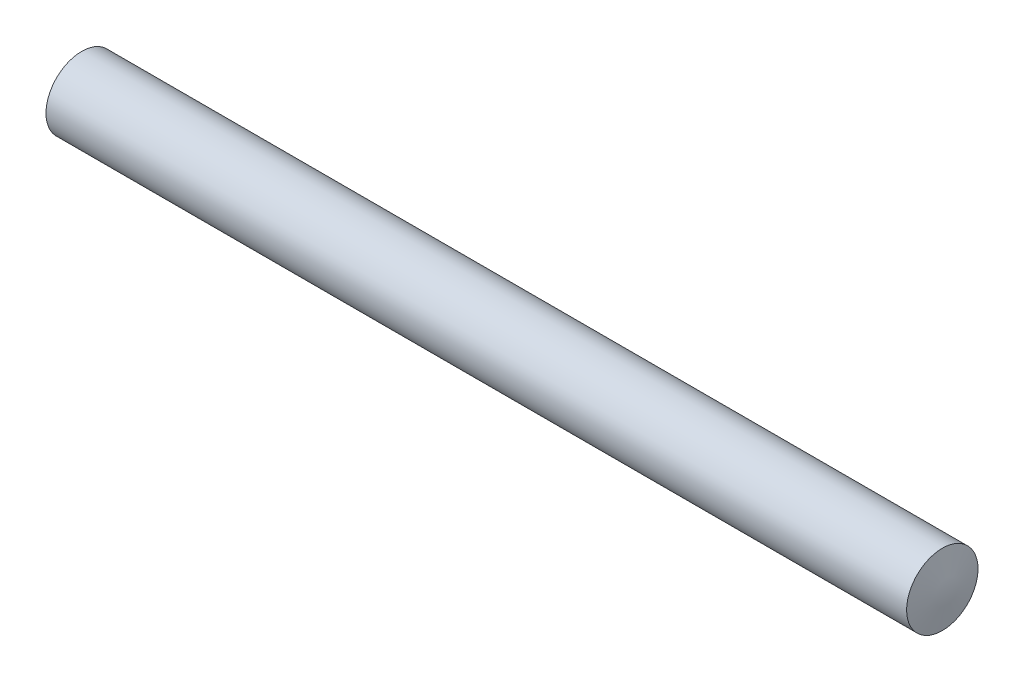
SolidWorks part; units mm, degrees
ref_plane "Front Plane" through (0, 0, 0) normal (0, 0, 1) x (1, 0, 0)
ref_plane "Top Plane" through (0, 0, 0) normal (0, 1, 0) x (1, 0, 0)
ref_plane "Right Plane" through (0, 0, 0) normal (1, 0, 0) x (0, 0, -1)
sketch "Sketch1" plane through (0, 0, 0) normal (0, 0, 1) x (1, 0, 0)
  line L0 (0, 0) -> (0, -25.4) construction
  line L1 (0, -12.7) -> (0, -82.55) construction
  line L2 (0, -82.55) -> (25.4, -82.55) construction
  line L3 (0, -12.7) -> (13.335, -12.7) construction
  line L4 (25.4, -82.55) -> (13.335, -12.7) construction
  line L5 (-3.81, -95.1738) -> (3.81, -95.1738) construction
  line L6 (11.7891, -94.5176) -> (0, 95.25) construction
  line L7 (0, 0) -> (11.7891, -94.5176) construction
  line L8 (6.6675, -12.7) -> (6.6675, -10.809) construction
  line L9 (0, -25.4) -> (15.5286, -25.4) construction
  line L10 (10.113, -12.7) -> (22.178, -82.55) construction
  line L11 (13.335, -12.7) -> (6.6675, -10.809) construction
  line L12 (0, -12.7) -> (10.6339, -15.7159) construction
  line L13 (6.6675, -10.809) -> (6.6675, -14.591) construction
  line L14 (6.6675, -14.591) -> (0, -14.591) construction
  line L15 (3.81, -95.1738) -> (3.81, -88.1137) construction
  line L16 (3.81, -88.1137) -> (19.685, -88.1137) construction
  line L17 (19.685, -88.1137) -> (19.685, -93.1937) construction
  line L18 (15.2087, -88.1137) -> (11.3126, -25.4) construction
  line L19 (12.0873, -24.13) -> (0, -24.13) construction
  circle A0 centre (0, 0) radius 95.25 construction
  circle A1 centre (0, 0) radius 12.7 construction
  circle A2 centre (0, -25.4) radius 69.85 construction
  arc A3 (3.81, -95.1738) -> (19.685, -93.1937) centre (0, 0) ccw construction
  circle A4 centre (7.4953, -25.4) radius 4.7411 construction
  point P29 (12.2364, -25.4)
  dimension "D1" = 190.5
  dimension "D3" = 25.4
  dimension "D8" = 15.875
  dimension "D2" = 25.4
  dimension "D4" = 69.85
  dimension "D5" = 50.8
  dimension "D6" = 26.67
  dimension "D7" = 7.62
  dimension "D9" = 7.11
  dimension "D10" = 3.175
  dimension "D11" = 5.08
  dimension "D12" = 2.54
  dimension "D13" = 7.62
sketch "Sketch2" plane through (0, 0, 0) normal (0, 0, 1) x (1, 0, 0)
  line L0 (0, 0) -> (0, -25.4) construction
  line L1 (0, -12.7) -> (0, -82.55) construction
  line L2 (0, -82.55) -> (25.4, -82.55) construction
  line L3 (0, -12.7) -> (13.335, -12.7) construction
  line L4 (25.4, -82.55) -> (13.335, -12.7) construction
  line L5 (-3.81, -95.1738) -> (3.81, -95.1738) construction
  line L6 (11.7891, -94.5176) -> (0, 95.25) construction
  line L7 (0, 0) -> (11.7891, -94.5176) construction
  line L8 (6.6675, -12.7) -> (6.6675, -10.809) construction
  line L9 (0, -25.4) -> (15.5286, -25.4) construction
  line L10 (10.113, -12.7) -> (22.178, -82.55) construction
  line L11 (13.335, -12.7) -> (6.6675, -10.809) construction
  line L12 (0, -12.7) -> (10.6339, -15.7159) construction
  line L13 (6.6675, -10.809) -> (6.6675, -14.591) construction
  line L14 (6.6675, -14.591) -> (0, -14.591) construction
  line L15 (3.81, -95.1738) -> (3.81, -88.1137) construction
  line L16 (3.81, -88.1137) -> (19.685, -88.1137) construction
  line L17 (19.685, -88.1137) -> (19.685, -93.1937) construction
  line L18 (15.2087, -88.1137) -> (11.3126, -25.4) construction
  line L19 (12.0873, -24.13) -> (0, -24.13) construction
  line L20 (0, -24.13) -> (15.3093, -24.13)
  line L21 (15.3093, -24.13) -> (15.5286, -25.4)
  line L22 (15.5286, -25.4) -> (0, -25.4)
  line L23 (0, -25.4) -> (0, -24.13)
  circle A0 centre (0, 0) radius 95.25 construction
  circle A1 centre (0, 0) radius 12.7 construction
  circle A2 centre (0, -25.4) radius 69.85 construction
  arc A3 (3.81, -95.1738) -> (19.685, -93.1937) centre (0, 0) ccw construction
  circle A4 centre (7.4953, -25.4) radius 4.7411 construction
  point P29 (12.2364, -25.4)
  dimension "D1" = 190.5
  dimension "D3" = 25.4
  dimension "D8" = 15.875
  dimension "D2" = 25.4
  dimension "D4" = 69.85
  dimension "D5" = 50.8
  dimension "D6" = 26.67
  dimension "D7" = 7.62
  dimension "D9" = 7.11
  dimension "D10" = 3.175
  dimension "D11" = 5.08
  dimension "D12" = 2.54
  dimension "D13" = 7.62
revolve "Revolve1" add sketch "Sketch2" angle 360 about L22
mirror "Mirror1" about plane through (0, 0, 0) normal (1, 0, 0)
